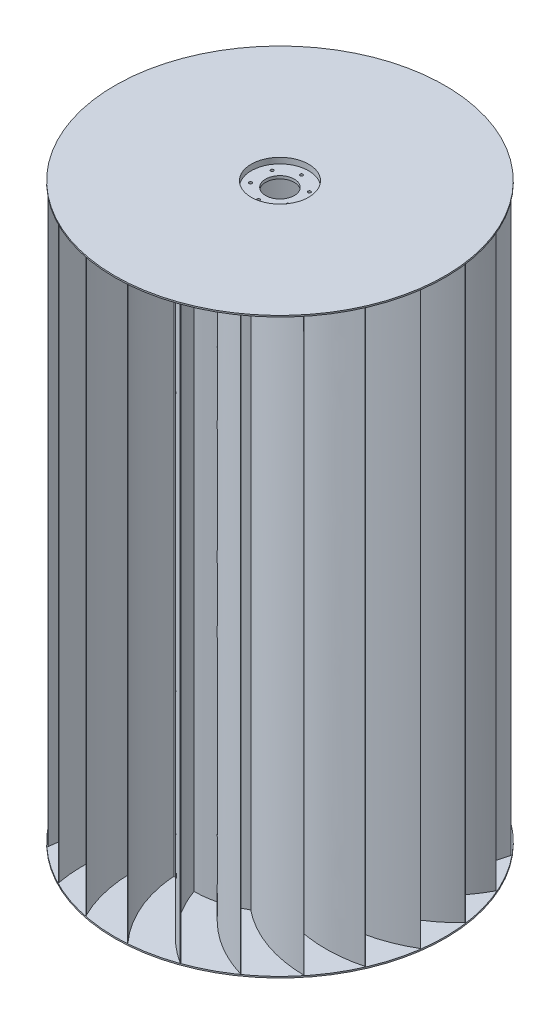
SolidWorks part; units mm, degrees
ref_plane "Front Plane" through (0, 0, 0) normal (0, 0, 1) x (1, 0, 0)
ref_plane "Top Plane" through (0, 0, 0) normal (0, 1, 0) x (1, 0, 0)
ref_plane "Right Plane" through (0, 0, 0) normal (1, 0, 0) x (0, 0, -1)
sketch "Sketch1" plane through (0, 0, 0) normal (0, 1, 0) x (1, 0, 0)
  line L0 (178.0857, 281.5156) -> (894.24, 281.5156) construction
  line L1 (0, 0) -> (291.4, 0) construction
  line L2 (291.4, 0) -> (291.4, 101.35) construction
  line L3 (329.1597, 173.3722) -> (328.7481, 171.9298)
  line L4 (291.4, 101.35) -> (291.3928, 99.85)
  line L5 (0, 0) -> (422.28, 0) construction
  line L6 (422.28, 0) -> (572.28, 0) construction
  line L7 (384.9505, 232.5361) -> (384.165, 231.2583)
  line L8 (454.6347, 274.454) -> (453.5335, 273.4354)
  line L9 (533.0441, 296.0168) -> (531.709, 295.3331)
  line L10 (614.3634, 295.6254) -> (612.8934, 295.3273)
  line L11 (692.5617, 273.3088) -> (691.0657, 273.4184)
  line L12 (761.8391, 230.7222) -> (760.4282, 231.2313)
  line L13 (817.0579, 171.024) -> (815.8366, 171.8948)
  line L14 (854.1226, 98.6416) -> (853.1815, 99.8097)
  line L15 (870.2843, 18.9435) -> (869.6933, 20.3222)
  line L16 (864.3444, -62.1595) -> (864.1472, -60.6725)
  line L17 (836.7434, -138.6525) -> (836.9548, -137.1675)
  line L18 (789.5284, -204.8623) -> (790.1326, -203.4893)
  line L19 (726.201, -255.8783) -> (727.1532, -254.7193)
  line L20 (651.4581, -287.9171) -> (652.6877, -287.0579)
  line L21 (570.8428, -298.6023) -> (572.2586, -298.1068)
  line L22 (490.3342, -287.1416) -> (491.8312, -287.0464)
  line L23 (415.9031, -254.3849) -> (417.3702, -254.6971)
  line L24 (353.0698, -202.7616) -> (354.3983, -203.4581)
  line L25 (306.4942, -136.1004) -> (307.5856, -137.1295)
  line L26 (279.6308, -59.3453) -> (280.4041, -60.6307)
  line L27 (274.4719, 21.8111) -> (274.8696, 20.3648)
  line L37 (572.28, 0) -> (-2.72, 331.9764) construction
  line L53 (572.28, 0) -> (572.28, 298.6058) construction
  line L54 (572.28, 0) -> (494.9951, 288.431) construction
  line L60 (291.4, 0) -> (331.4, 0) construction
  line L61 (331.4, 0) -> (326.8069, -159.0563) construction
  line L64 (-3254.2492, -2442.3946) -> (-2722.2492, -2442.3946) construction
  line L65 (-2229.3323, -3488.2746) -> (-1793.999, -3488.2746) construction
  arc A0 (21.2217, 154.3993) -> (21.8009, 153.0156) centre (21.5113, 153.7075) ccw
  arc A3 (83.3129, 297.3475) -> (83.4973, 295.8589) centre (83.4051, 296.6032) ccw
  arc A4 (181.6685, 418.2428) -> (181.4445, 416.7596) centre (181.5565, 417.5012) ccw
  arc A5 (308.994, 508.119) -> (308.3781, 506.7512) centre (308.686, 507.4351) ccw
  arc A6 (455.8462, 560.3102) -> (454.8841, 559.1594) centre (455.3652, 559.7348) ccw
  arc A7 (611.3338, 570.9459) -> (610.0969, 570.0973) centre (610.7153, 570.5216) ccw
  arc A8 (763.9249, 539.2371) -> (762.5049, 538.7536) centre (763.2149, 538.9954) ccw
  arc A9 (902.3026, 467.5355) -> (900.8049, 467.4531) centre (901.5537, 467.4943) ccw
  arc A10 (1016.2041, 361.159) -> (1014.7396, 361.4837) centre (1015.4718, 361.3214) ccw
  arc A11 (1097.1817, 227.997) -> (1095.8592, 228.7048) centre (1096.5204, 228.3509) ccw
  arc A12 (1139.2298, 77.9254) -> (1138.1472, 78.9638) centre (1138.6885, 78.4446) ccw
  arc A13 (1139.2298, -77.9254) -> (1138.4675, -76.6336) centre (1138.8486, -77.2795) ccw
  arc A14 (1097.1817, -227.997) -> (1096.7963, -226.5473) centre (1096.989, -227.2722) ccw
  arc A15 (1016.2041, -361.159) -> (1016.224, -359.6591) centre (1016.214, -360.4091) ccw
  arc A16 (902.3026, -467.5355) -> (902.7265, -466.0967) centre (902.5146, -466.8161) ccw
  arc A17 (763.9249, -539.2371) -> (764.7213, -537.9659) centre (764.3231, -538.6015) ccw
  arc A18 (611.3338, -570.9459) -> (612.4436, -569.9367) centre (611.8887, -570.4413) ccw
  arc A19 (455.8462, -560.3102) -> (457.1871, -559.6379) centre (456.5166, -559.9741) ccw
  arc A20 (308.994, -508.119) -> (310.4665, -507.8334) centre (309.7303, -507.9762) ccw
  arc A21 (181.6685, -418.2428) -> (183.1635, -418.3651) centre (182.416, -418.304) ccw
  arc A22 (83.3129, -297.3475) -> (84.7194, -297.8686) centre (84.0162, -297.6081) ccw
  arc A23 (21.2217, -154.3993) -> (22.4355, -155.2806) centre (21.8286, -154.8399) ccw
  arc A32 (0, 0) -> (0.931, -1.1761) centre (0.4655, -0.588) ccw
  spline S0 degree 3 poles (0, 0) (89.3651, 70.7464) (194.9163, 101.8134) (291.4, 101.35) knots 0 0 0 0 1 1 1 1
  spline S1 degree 1 poles (0.931, -1.1761) (291.3928, 99.85) knots 0 0 1 1 construction
  spline S2 degree 3 poles (0.931, -1.1761) (3.7058, 1.0206) (9.3181, 5.3614) (20.6296, 13.7099) (34.9935, 23.5824) (52.5297, 34.5223) (76.2696, 47.9218) (106.5205, 62.4721) (143.4498, 76.5103) (180.7115, 87.2211) (211.794, 93.4533) (236.5301, 96.8705) (254.9815, 98.661) (270.2383, 99.5194) (282.3643, 99.8319) (288.3793, 99.8645) (291.3928, 99.85) knots 0 0 0 0 0.03125 0.0625 0.125 0.1875 0.25 0.375 0.5 0.625 0.75 0.8125 0.875 0.9375 0.96875 1 1 1 1
  spline S3 degree 3 poles (21.8009, 153.0156) (25.0654, 154.3822) (31.6407, 157.0479) (44.7852, 162.035) (61.28, 167.6661) (81.1175, 173.4691) (107.5921, 179.9667) (140.6469, 185.8159) (179.9942, 189.3701) (218.7639, 189.6307) (250.3752, 187.2457) (275.1159, 183.8625) (293.3662, 180.6085) (308.2888, 177.3189) (320.0495, 174.3482) (325.8502, 172.7567) (328.7481, 171.9298) knots 0 0 0 0 0.03125 0.0625 0.125 0.1875 0.25 0.375 0.5 0.625 0.75 0.8125 0.875 0.9375 0.96875 1 1 1 1
  spline S4 degree 3 poles (21.2217, 154.3993) (126.36, 198.4118) (236.3789, 199.8494) (329.1597, 173.3722) knots 0 0 0 0 1 1 1 1
  spline S5 degree 3 poles (83.4973, 295.8589) (87.0094, 296.294) (94.0601, 297.0868) (108.0627, 298.3427) (125.4651, 299.3147) (146.1325, 299.5505) (173.3785, 298.6644) (206.7856, 295.3785) (245.6327, 288.1852) (283.035, 277.9761) (312.8306, 267.151) (335.7411, 257.2183) (352.4367, 249.1611) (365.9184, 241.9674) (376.4414, 235.9339) (381.5977, 232.8364) (384.165, 231.2583) knots 0 0 0 0 0.03125 0.0625 0.125 0.1875 0.25 0.375 0.5 0.625 0.75 0.8125 0.875 0.9375 0.96875 1 1 1 1
  spline S6 degree 3 poles (83.3129, 297.3475) (196.4268, 311.3619) (302.7537, 283.0635) (384.9505, 232.5361) knots 0 0 0 0 1 1 1 1
  spline S7 degree 3 poles (181.4445, 416.7596) (184.9438, 416.2311) (191.9468, 415.0922) (205.769, 412.5236) (222.7883, 408.7645) (242.753, 403.4155) (268.7495, 395.2114) (300.0313, 383.0343) (335.4971, 365.6269) (368.758, 345.7054) (394.5282, 327.243) (413.9092, 311.4974) (427.8119, 299.2345) (438.8529, 288.6703) (447.3579, 280.0214) (451.4872, 275.6477) (453.5335, 273.4354) knots 0 0 0 0 0.03125 0.0625 0.125 0.1875 0.25 0.375 0.5 0.625 0.75 0.8125 0.875 0.9375 0.96875 1 1 1 1
  spline S8 degree 3 poles (181.6685, 418.2428) (294.3689, 401.2198) (389.1181, 345.284) (454.6347, 274.454) knots 0 0 0 0 1 1 1 1
  spline S9 degree 3 poles (308.3781, 506.7512) (311.605, 505.2982) (318.0412, 502.3122) (330.6578, 496.1096) (346.0318, 487.8981) (363.8129, 477.3611) (386.632, 462.4475) (413.4684, 442.2822) (442.9226, 415.9517) (469.5754, 387.7953) (489.4088, 363.0648) (503.823, 342.6741) (513.9017, 327.1151) (521.683, 313.9638) (527.5392, 303.3411) (530.3354, 298.0154) (531.709, 295.3331) knots 0 0 0 0 0.03125 0.0625 0.125 0.1875 0.25 0.375 0.5 0.625 0.75 0.8125 0.875 0.9375 0.96875 1 1 1 1
  spline S10 degree 3 poles (308.994, 508.119) (412.9224, 461.321) (489.0667, 381.8964) (533.0441, 296.0168) knots 0 0 0 0 1 1 1 1
  spline S11 degree 3 poles (454.8841, 559.1594) (457.5994, 556.8896) (462.9912, 552.2779) (473.4666, 542.9014) (486.055, 530.8466) (500.3339, 515.903) (518.2831, 495.3859) (538.6839, 468.728) (559.9419, 435.4273) (578.0099, 401.1241) (590.4356, 371.9597) (598.814, 348.4363) (604.3211, 330.735) (608.2657, 315.9721) (611.0387, 304.1633) (612.2944, 298.2807) (612.8934, 295.3273) knots 0 0 0 0 0.03125 0.0625 0.125 0.1875 0.25 0.375 0.5 0.625 0.75 0.8125 0.875 0.9375 0.96875 1 1 1 1
  spline S12 degree 3 poles (455.8462, 560.3102) (543.2947, 487.2081) (595.1869, 390.1854) (614.3634, 295.6254) knots 0 0 0 0 1 1 1 1
  spline S13 degree 3 poles (610.0969, 570.0973) (612.0991, 567.1791) (616.0467, 561.2837) (623.6039, 549.4287) (632.4732, 534.4246) (642.1909, 516.1828) (653.939, 491.5838) (666.391, 460.4104) (677.8764, 422.6093) (686.0194, 384.7035) (690.1159, 353.2681) (691.837, 328.3565) (692.3642, 309.8259) (692.1795, 294.5462) (691.6637, 282.4271) (691.2858, 276.4239) (691.0657, 273.4184) knots 0 0 0 0 0.03125 0.0625 0.125 0.1875 0.25 0.375 0.5 0.625 0.75 0.8125 0.875 0.9375 0.96875 1 1 1 1
  spline S14 degree 3 poles (611.3338, 570.9459) (675.8168, 476.9612) (699.6082, 369.536) (692.5617, 273.3088) knots 0 0 0 0 1 1 1 1
  spline S15 degree 3 poles (762.5049, 538.7536) (763.6456, 535.4035) (765.8563, 528.6616) (769.9347, 515.2074) (774.4271, 498.3668) (778.8628, 478.1796) (783.5386, 451.3232) (787.1184, 417.9463) (787.9792, 378.4482) (785.5934, 339.7511) (781.0568, 308.3763) (775.9931, 283.9241) (771.5012, 265.9384) (767.2009, 251.2751) (763.4346, 239.7446) (761.451, 234.066) (760.4282, 231.2313) knots 0 0 0 0 0.03125 0.0625 0.125 0.1875 0.25 0.375 0.5 0.625 0.75 0.8125 0.875 0.9375 0.96875 1 1 1 1
  spline S16 degree 3 poles (763.9249, 539.2371) (800.6599, 431.3403) (794.5862, 321.4799) (761.8391, 230.7222) knots 0 0 0 0 1 1 1 1
  spline S17 degree 3 poles (900.8049, 467.4531) (900.9993, 463.9195) (901.3091, 456.8312) (901.6065, 442.7755) (901.3886, 425.3473) (900.2135, 404.712) (897.4701, 377.59) (891.9122, 344.485) (882.0846, 306.2194) (869.3469, 269.601) (856.5137, 240.6135) (845.0406, 218.4343) (835.8628, 202.3274) (827.7659, 189.3681) (821.0284, 179.2813) (817.5862, 174.3485) (815.8366, 171.8948) knots 0 0 0 0 0.03125 0.0625 0.125 0.1875 0.25 0.375 0.5 0.625 0.75 0.8125 0.875 0.9375 0.96875 1 1 1 1
  spline S18 degree 3 poles (902.3026, 467.5355) (908.5652, 353.7289) (873.0767, 249.581) (817.0579, 171.024) knots 0 0 0 0 1 1 1 1
  spline S19 degree 3 poles (1014.7396, 361.4837) (1013.9735, 358.0287) (1012.3594, 351.1196) (1008.8536, 337.505) (1003.9417, 320.7819) (997.2428, 301.2288) (987.2837, 275.8527) (973.0003, 245.4749) (953.2132, 211.2797) (931.0683, 179.4557) (910.8903, 155.0056) (893.8588, 136.7442) (880.6758, 123.7108) (869.3827, 113.4165) (860.1736, 105.5216) (855.5283, 101.7003) (853.1815, 99.8097) knots 0 0 0 0 0.03125 0.0625 0.125 0.1875 0.25 0.375 0.5 0.625 0.75 0.8125 0.875 0.9375 0.96875 1 1 1 1
  spline S20 degree 3 poles (1016.2041, 361.159) (991.5297, 249.883) (929.2585, 159.1719) (854.1226, 98.6416) knots 0 0 0 0 1 1 1 1
  spline S21 degree 3 poles (1095.8592, 228.7048) (1094.1893, 225.5845) (1090.771, 219.3671) (1083.722, 207.2032) (1074.4805, 192.4255) (1062.7546, 175.4048) (1046.3185, 153.6567) (1024.3688, 128.259) (996.0897, 100.6703) (966.18, 76.0011) (940.1537, 57.9016) (918.8269, 44.9125) (902.6164, 35.9191) (888.9647, 29.0534) (877.9671, 23.9358) (872.4631, 21.5095) (869.6933, 20.3222) knots 0 0 0 0 0.03125 0.0625 0.125 0.1875 0.25 0.375 0.5 0.625 0.75 0.8125 0.875 0.9375 0.96875 1 1 1 1
  spline S22 degree 3 poles (1097.1817, 227.997) (1043.4005, 127.5044) (958.9648, 56.9577) (870.2843, 18.9435) knots 0 0 0 0 1 1 1 1
  spline S23 degree 3 poles (1138.1472, 78.9638) (1135.6974, 76.4098) (1130.7285, 71.3452) (1120.6591, 61.5342) (1107.7733, 49.7977) (1091.8901, 36.5719) (1070.1959, 20.0646) (1042.208, 1.5307) (1007.5342, -17.4053) (972.078, -33.0902) (942.1336, -43.4967) (918.0933, -50.2503) (900.0575, -54.5366) (885.0597, -57.4645) (873.0892, -59.4252) (867.1347, -60.2765) (864.1472, -60.6725) knots 0 0 0 0 0.03125 0.0625 0.125 0.1875 0.25 0.375 0.5 0.625 0.75 0.8125 0.875 0.9375 0.96875 1 1 1 1
  spline S24 degree 3 poles (1139.2298, 77.9254) (1060.3303, -4.3306) (959.9925, -49.4807) (864.3444, -62.1595) knots 0 0 0 0 1 1 1 1
  spline S25 degree 3 poles (1138.4675, -76.6336) (1135.4195, -78.4319) (1129.2684, -81.9681) (1116.9254, -88.6986) (1101.351, -96.5233) (1082.4885, -104.9734) (1057.1452, -115.0155) (1025.1948, -125.3111) (986.6979, -134.1901) (948.3248, -139.7273) (916.6832, -141.669) (891.7122, -141.6862) (873.1888, -140.9475) (857.9573, -139.7205) (845.9017, -138.3789) (839.9382, -137.5922) (836.9548, -137.1675) knots 0 0 0 0 0.03125 0.0625 0.125 0.1875 0.25 0.375 0.5 0.625 0.75 0.8125 0.875 0.9375 0.96875 1 1 1 1
  spline S26 degree 3 poles (1139.2298, -77.9254) (1041.0637, -135.8444) (932.2654, -152.2494) (836.7434, -138.6525) knots 0 0 0 0 1 1 1 1
  spline S27 degree 3 poles (1096.7963, -226.5473) (1093.3761, -227.4567) (1086.4991, -229.2021) (1072.7979, -232.353) (1055.6899, -235.6856) (1035.2471, -238.7334) (1008.1343, -241.5655) (974.5909, -242.8592) (935.1261, -241.0226) (896.6821, -236.0015) (865.6899, -229.3344) (841.6403, -222.6138) (824.0031, -216.905) (809.6674, -211.6141) (798.4208, -207.0697) (792.8908, -204.7032) (790.1326, -203.4893) knots 0 0 0 0 0.03125 0.0625 0.125 0.1875 0.25 0.375 0.5 0.625 0.75 0.8125 0.875 0.9375 0.96875 1 1 1 1
  spline S28 degree 3 poles (1097.1817, -227.997) (987.0296, -257.2832) (877.8397, -243.7265) (789.5284, -204.8623) knots 0 0 0 0 1 1 1 1
  spline S29 degree 3 poles (1016.224, -359.6591) (1012.6854, -359.612) (1005.5924, -359.4374) (991.5493, -358.7748) (974.1766, -357.3681) (953.6695, -354.7875) (926.798, -350.1997) (894.1495, -342.3955) (856.6437, -329.9795) (820.9799, -314.7726) (792.9358, -299.9911) (771.5912, -287.0312) (756.1482, -276.7757) (743.7717, -267.8132) (734.1682, -260.4031) (729.4817, -256.6323) (727.1532, -254.7193) knots 0 0 0 0 0.03125 0.0625 0.125 0.1875 0.25 0.375 0.5 0.625 0.75 0.8125 0.875 0.9375 0.96875 1 1 1 1
  spline S30 degree 3 poles (1016.2041, -361.159) (902.2353, -359.6406) (800.7521, -317.1275) (726.201, -255.8783) knots 0 0 0 0 1 1 1 1
  spline S31 degree 3 poles (902.7265, -466.0967) (899.3318, -465.0966) (892.549, -463.0147) (879.2053, -458.588) (862.8564, -452.5464) (843.8061, -444.5287) (819.1688, -432.8611) (789.8365, -416.5379) (757.0713, -394.4634) (726.8328, -370.1984) (703.8167, -348.3989) (686.7601, -330.1609) (674.6567, -316.1191) (665.1571, -304.1499) (657.909, -294.4235) (654.4137, -289.5282) (652.6877, -287.0579) knots 0 0 0 0 0.03125 0.0625 0.125 0.1875 0.25 0.375 0.5 0.625 0.75 0.8125 0.875 0.9375 0.96875 1 1 1 1
  spline S32 degree 3 poles (902.3026, -467.5355) (792.9698, -435.325) (706.7198, -367.0086) (651.4581, -287.9171) knots 0 0 0 0 1 1 1 1
  spline S33 degree 3 poles (764.7213, -537.9659) (761.7223, -536.087) (755.7527, -532.2524) (744.0982, -524.3897) (729.9855, -514.1613) (713.8047, -501.3012) (693.229, -483.4193) (669.3883, -459.7876) (643.7938, -429.6917) (621.2232, -398.1683) (604.942, -370.9675) (593.4386, -348.804) (585.5724, -332.0175) (579.6543, -317.9291) (575.2991, -306.6079) (573.2542, -300.9511) (572.2586, -298.1068) knots 0 0 0 0 0.03125 0.0625 0.125 0.1875 0.25 0.375 0.5 0.625 0.75 0.8125 0.875 0.9375 0.96875 1 1 1 1
  spline S34 degree 3 poles (763.9249, -539.2371) (667.3368, -478.7234) (602.7167, -389.6703) (570.8428, -298.6023) knots 0 0 0 0 1 1 1 1
  spline S35 degree 3 poles (612.4436, -569.9367) (610.0627, -567.3184) (605.349, -562.0154) (596.248, -551.2999) (585.4183, -537.6432) (573.3072, -520.8945) (558.3189, -498.1244) (541.7381, -468.9369) (525.2125, -433.0518) (511.9838, -396.6078) (503.645, -366.0231) (498.5477, -341.5779) (495.5022, -323.2916) (493.6046, -308.129) (492.4654, -296.0526) (492.0224, -290.0539) (491.8312, -287.0464) knots 0 0 0 0 0.03125 0.0625 0.125 0.1875 0.25 0.375 0.5 0.625 0.75 0.8125 0.875 0.9375 0.96875 1 1 1 1
  spline S36 degree 3 poles (611.3338, -570.9459) (534.6538, -486.617) (496.4562, -383.432) (490.3342, -287.1416) knots 0 0 0 0 1 1 1 1
  spline S37 degree 3 poles (457.1871, -559.6379) (455.6009, -556.4743) (452.4928, -550.0963) (446.6203, -537.3227) (439.8767, -521.2506) (432.7334, -501.8555) (424.4442, -475.8859) (416.353, -443.3074) (410.1219, -404.2944) (407.2162, -365.6328) (407.4383, -333.9325) (409.1253, -309.0185) (411.1263, -290.5887) (413.3899, -275.4764) (415.5511, -263.5405) (416.743, -257.6446) (417.3702, -254.6971) knots 0 0 0 0 0.03125 0.0625 0.125 0.1875 0.25 0.375 0.5 0.625 0.75 0.8125 0.875 0.9375 0.96875 1 1 1 1
  spline S38 degree 3 poles (455.8462, -560.3102) (404.7614, -458.4205) (395.8192, -348.7563) (415.9031, -254.3849) knots 0 0 0 0 1 1 1 1
  spline S39 degree 3 poles (310.4665, -507.8334) (309.7927, -504.3591) (308.5206, -497.379) (306.3122, -483.4948) (304.1548, -466.1993) (302.5092, -445.5961) (301.5339, -418.3532) (302.5323, -384.7997) (307.0578, -345.5523) (314.6907, -307.5405) (323.4572, -277.0756) (331.8033, -253.5407) (338.7024, -236.3341) (344.9593, -222.393) (350.2606, -211.4827) (352.999, -206.1271) (354.3983, -203.4581) knots 0 0 0 0 0.03125 0.0625 0.125 0.1875 0.25 0.375 0.5 0.625 0.75 0.8125 0.875 0.9375 0.96875 1 1 1 1
  spline S40 degree 3 poles (308.994, -508.119) (287.293, -396.2251) (308.2696, -288.2149) (353.0698, -202.7616) knots 0 0 0 0 1 1 1 1
  spline S41 degree 3 poles (183.1635, -418.3651) (183.452, -414.8379) (184.1103, -407.7734) (185.7296, -393.8082) (188.3186, -376.572) (192.2926, -356.2889) (198.7036, -329.7931) (208.7175, -297.7532) (223.6641, -261.1822) (241.2693, -226.6393) (257.9301, -199.6693) (272.3164, -179.2589) (283.6019, -164.5518) (293.3881, -152.8157) (301.4364, -143.7402) (305.5181, -139.322) (307.5856, -137.1295) knots 0 0 0 0 0.03125 0.0625 0.125 0.1875 0.25 0.375 0.5 0.625 0.75 0.8125 0.875 0.9375 0.96875 1 1 1 1
  spline S42 degree 3 poles (181.6685, -418.2428) (190.9609, -304.6434) (240.3003, -206.2979) (306.4942, -136.1004) knots 0 0 0 0 1 1 1 1
  spline S43 degree 3 poles (84.7194, -297.8686) (85.9489, -294.55) (88.4887, -287.9251) (93.8158, -274.9147) (100.959, -259.0161) (110.258, -240.5574) (123.5797, -216.7738) (141.8666, -188.6238) (166.1256, -157.4414) (192.3976, -128.9293) (215.7169, -107.4544) (235.0764, -91.6823) (249.9114, -80.5653) (262.501, -71.9047) (272.6993, -65.3372) (277.8217, -62.1841) (280.4041, -60.6307) knots 0 0 0 0 0.03125 0.0625 0.125 0.1875 0.25 0.375 0.5 0.625 0.75 0.8125 0.875 0.9375 0.96875 1 1 1 1
  spline S44 degree 3 poles (83.3129, -297.3475) (122.9094, -190.4677) (196.9525, -109.0808) (279.6308, -59.3453) knots 0 0 0 0 1 1 1 1
  spline S45 degree 3 poles (22.4355, -155.2806) (24.5147, -152.4168) (28.7477, -146.7228) (37.3875, -135.632) (48.5551, -122.2502) (62.4894, -106.9848) (81.7338, -87.6773) (106.9374, -65.5049) (138.7097, -42.0239) (171.6999, -21.6572) (199.9484, -7.2702) (222.8452, 2.694) (240.1294, 9.3963) (254.5888, 14.3391) (266.1808, 17.9116) (271.964, 19.5657) (274.8696, 20.3648) knots 0 0 0 0 0.03125 0.0625 0.125 0.1875 0.25 0.375 0.5 0.625 0.75 0.8125 0.875 0.9375 0.96875 1 1 1 1
  spline S46 degree 3 poles (21.2217, -154.3993) (88.1857, -62.1659) (181.441, -3.7737) (274.4719, 21.8111) knots 0 0 0 0 1 1 1 1
  point P11 (572.28, 0)
  point P104 (572.28, 0)
  point P137 (572.28, 0)
  point P145 (572.28, 0)
  point P154 (572.28, 0)
  point P167 (572.28, 0)
  point P172 (572.28, 0)
  point P189 (572.28, 0)
  point P203 (572.28, 0)
  point P243 (572.28, 0)
  dimension "D7" = 15
  dimension "D11" = 40
  dimension "D1" = 291.4
  dimension "D2" = 101.35
  dimension "D4" = 422.28
  dimension "D5" = 150
  dimension "D16" = 60
  dimension "D3" = 1.5
extrude "Boss-Extrude1" add sketch "Sketch1" along normal mid plane 2000
sketch "Sketch2" plane through (0, 0, 0) normal (0, 1, 0) x (1, 0, 0)
  circle A0 centre (572.28, 0) radius 300
  dimension "D1" = 600
extrude "Extrude-Thin1" add sketch "Sketch2" along normal mid plane 2000 thin
sketch "Sketch4" plane through (0, 0, 0) normal (0, 1, 0) x (1, 0, 0)
  circle A0 centre (572.28, 0) radius 295 construction
  circle A1 centre (572.28, 0) radius 295
extrude "Extrude-Thin2" add sketch "Sketch4" along normal mid plane 30 thin
pattern_linear "LPattern1" count 2 spacing 985 along (0, 1, 0) count 2 spacing 985 along (0, -1, 0) of "Extrude-Thin2"
sketch "Sketch5" plane through (0, 1000, 0) normal (0, 1, 0) x (1, 0, 0)
  circle A0 centre (572.28, 0) radius 100 construction
  circle A1 centre (572.28, 0) radius 100
  circle A2 centre (572.28, 0) radius 75
  dimension "D1" = 150
extrude "Boss-Extrude2" add sketch "Sketch5" against normal up to surface (30 mm away)
sketch "Sketch6" plane through (0, 15, 0) normal (0, 1, 0) x (1, 0, 0)
  circle A0 centre (572.28, 0) radius 100 construction
  circle A1 centre (572.28, 0) radius 100
  circle A2 centre (572.28, 0) radius 75 construction
  circle A3 centre (572.28, 0) radius 75
extrude "Boss-Extrude3" add sketch "Sketch6" against normal blind 30
sketch "Sketch7" plane through (0, -970, 0) normal (0, 1, 0) x (1, 0, 0)
  circle A0 centre (572.28, 0) radius 100 construction
  circle A1 centre (572.28, 0) radius 100
  circle A2 centre (572.28, 0) radius 75 construction
  circle A3 centre (572.28, 0) radius 75
extrude "Boss-Extrude4" add sketch "Sketch7" against normal blind 30
sketch "Sketch8" plane through (0, 1000, 0) normal (0, 1, 0) x (1, 0, 0)
  circle A0 centre (572.28, 0) radius 575
  circle A1 centre (572.28, 0) radius 75 construction
  circle A2 centre (572.28, 0) radius 75
  dimension "D1" = 1150
extrude "Boss-Extrude5" add sketch "Sketch8" against normal blind 5
mirror "Mirror1" about plane through (0, 0, 0) normal (0, 1, 0) of "Boss-Extrude5"
sketch "Sketch10" plane through (0, 15, 0) normal (0, 1, 0) x (1, 0, 0)
  circle A0 centre (572.28, 0) radius 105
  dimension "D1" = 210
extrude "Cut-Extrude1" cut sketch "Sketch10" against normal up to surface (30 mm away)
sketch "Sketch11" plane through (0, -970, 0) normal (0, 1, 0) x (1, 0, 0)
  circle A0 centre (572.28, 0) radius 50
  circle A1 centre (572.28, 0) radius 100
  dimension "D1" = 100
  dimension "D2" = 200
extrude "Boss-Extrude6" add sketch "Sketch11" against normal up to surface (30 mm away)
sketch "Sketch12" plane through (0, -970, 0) normal (0, 1, 0) x (1, 0, 0)
  circle A0 centre (572.28, 0) radius 100 construction
  circle A1 centre (572.28, 0) radius 50 construction
  circle A2 centre (572.28, 0) radius 100
  circle A3 centre (572.28, 0) radius 50
extrude "Cut-Extrude2" cut sketch "Sketch12" against normal blind 10
sketch "Sketch13" plane through (0, -1000, 0) normal (0, -1, 0) x (1, 0, 0)
  circle A0 centre (572.28, 0) radius 100 construction
  circle A1 centre (572.28, 0) radius 50 construction
  circle A2 centre (572.28, 0) radius 100
  circle A3 centre (572.28, 0) radius 50
extrude "Cut-Extrude3" cut sketch "Sketch13" against normal blind 10
sketch "Sketch14" plane through (0, -980, 0) normal (0, 1, 0) x (1, 0, 0)
  line L0 (572.28, 50) -> (572.28, 0) construction
  line L1 (572.28, 100) -> (572.28, 50) construction
  line L2 (472.28, 0) -> (572.28, 0) construction
  circle A2 centre (572.28, 75) radius 5
  circle A3 centre (572.28, 0) radius 100 construction
  circle A4 centre (572.28, 0) radius 100 construction
  circle A5 centre (572.28, 0) radius 50 construction
  circle A6 centre (637.2319, 37.5) radius 5
  circle A7 centre (637.2319, -37.5) radius 5
  circle A8 centre (572.28, -75) radius 5
  circle A9 centre (507.3281, -37.5) radius 5
  circle A10 centre (507.3281, 37.5) radius 5
  point P27 (572.28, 0)
  dimension "D1" = 10
  dimension "D2" = 100
  dimension "D3" = 6
extrude "Cut-Extrude4" cut sketch "Sketch14" against normal blind 10
sketch "Sketch15" plane through (0, 1000, 0) normal (0, 1, 0) x (1, 0, 0)
  circle A0 centre (572.28, 0) radius 100
  circle A1 centre (572.28, 0) radius 50
  dimension "D1" = 200
  dimension "D2" = 100
extrude "Boss-Extrude7" add sketch "Sketch15" against normal up to surface (30 mm away)
sketch "Sketch16" plane through (0, 970, 0) normal (0, -1, 0) x (1, 0, 0)
  circle A0 centre (572.28, 0) radius 100 construction
  circle A1 centre (572.28, 0) radius 50 construction
  circle A2 centre (572.28, 0) radius 100
  circle A3 centre (572.28, 0) radius 50
extrude "Cut-Extrude6" cut sketch "Sketch16" along normal blind 20 from surface at -30
sketch "Sketch18" plane through (0, 980, 0) normal (0, 1, 0) x (1, 0, 0)
  circle A0 centre (572.28, 75) radius 5 construction
  circle A1 centre (637.2319, 37.5) radius 5 construction
  circle A2 centre (637.2319, -37.5) radius 5 construction
  circle A3 centre (572.28, -75) radius 5 construction
  circle A4 centre (507.3281, -37.5) radius 5 construction
  circle A5 centre (507.3281, 37.5) radius 5 construction
  circle A6 centre (572.28, 75) radius 5
  circle A7 centre (637.2319, 37.5) radius 5
  circle A8 centre (637.2319, -37.5) radius 5
  circle A9 centre (572.28, -75) radius 5
  circle A10 centre (507.3281, -37.5) radius 5
  circle A11 centre (507.3281, 37.5) radius 5
extrude "Cut-Extrude7" cut sketch "Sketch18" against normal blind 20
